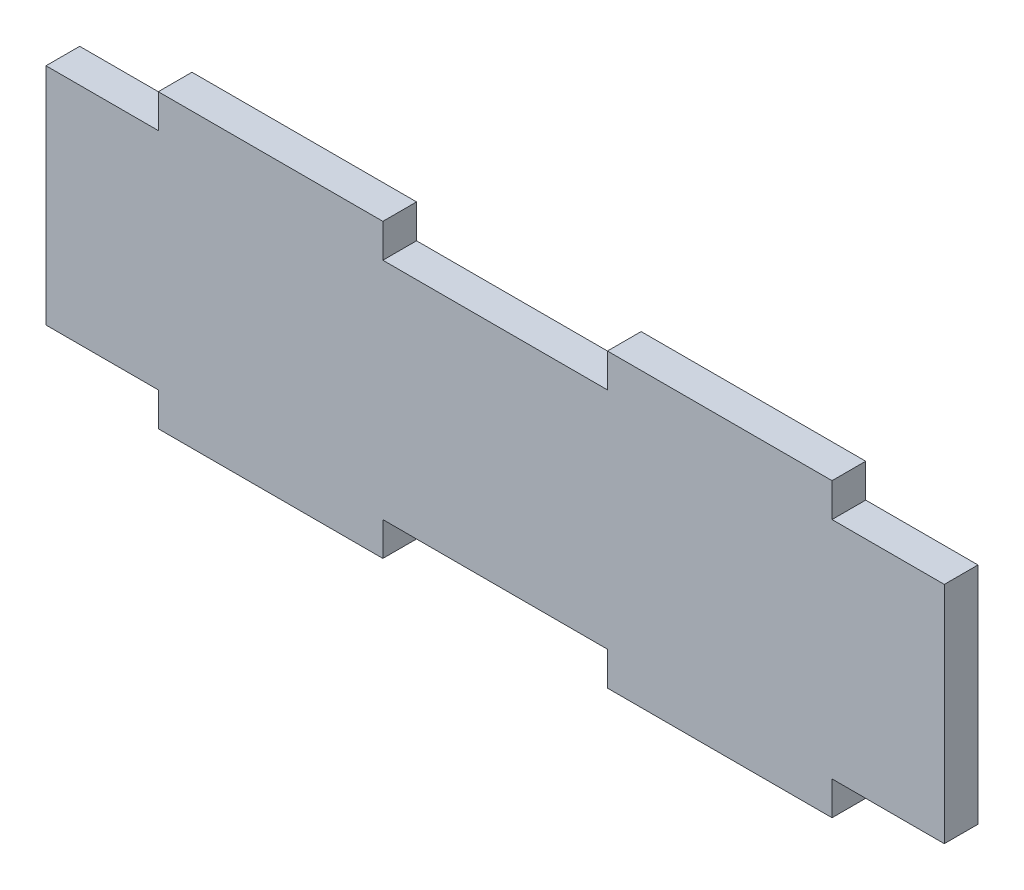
SolidWorks part; units mm, degrees
ref_plane "Front Plane" through (0, 0, 0) normal (0, 0, 1) x (1, 0, 0)
ref_plane "Top Plane" through (0, 0, 0) normal (0, 1, 0) x (1, 0, 0)
ref_plane "Right Plane" through (0, 0, 0) normal (1, 0, 0) x (0, 0, -1)
sketch "Sketch2" plane through (0, 0, 0) normal (0, 0, 1) x (1, 0, 0)
  line L0 (0, 20) -> (10, 20) construction
  line L1 (0, 0) -> (80, 0)
  line L2 (0, 0) -> (0, 20)
  line L3 (0, 20) -> (80, 20)
  line L4 (80, 0) -> (80, 20)
  line L5 (0, 10) -> (80, 10) construction
  line L6 (10, 20) -> (30, 20)
  line L7 (10, 20) -> (10, 23)
  line L8 (10, 23) -> (30, 23)
  line L9 (30, 20) -> (30, 23)
  line L10 (40, 20) -> (40, 0) construction
  line L11 (30, 0) -> (30, -3)
  line L12 (10, -3) -> (30, -3)
  line L13 (10, 0) -> (10, -3)
  line L14 (10, 0) -> (30, 0)
  line L15 (50, 20) -> (50, 23)
  line L16 (70, 23) -> (50, 23)
  line L17 (70, 20) -> (70, 23)
  line L18 (70, 20) -> (50, 20)
  line L19 (70, 0) -> (50, 0)
  line L20 (70, 0) -> (70, -3)
  line L21 (70, -3) -> (50, -3)
  line L22 (50, 0) -> (50, -3)
  dimension "D1" = 20
  dimension "D2" = 80
  dimension "D3" = 10
  dimension "D4" = 3
  dimension "D5" = 20
extrude "Boss-Extrude1" add sketch "Sketch2" along normal blind 3 contours L2 L3 L4 L1 | L8 L9 L6 L7 | L16 L15 L18 L17 | L12 L11 L14 L13 | L21 L22 L19 L20
